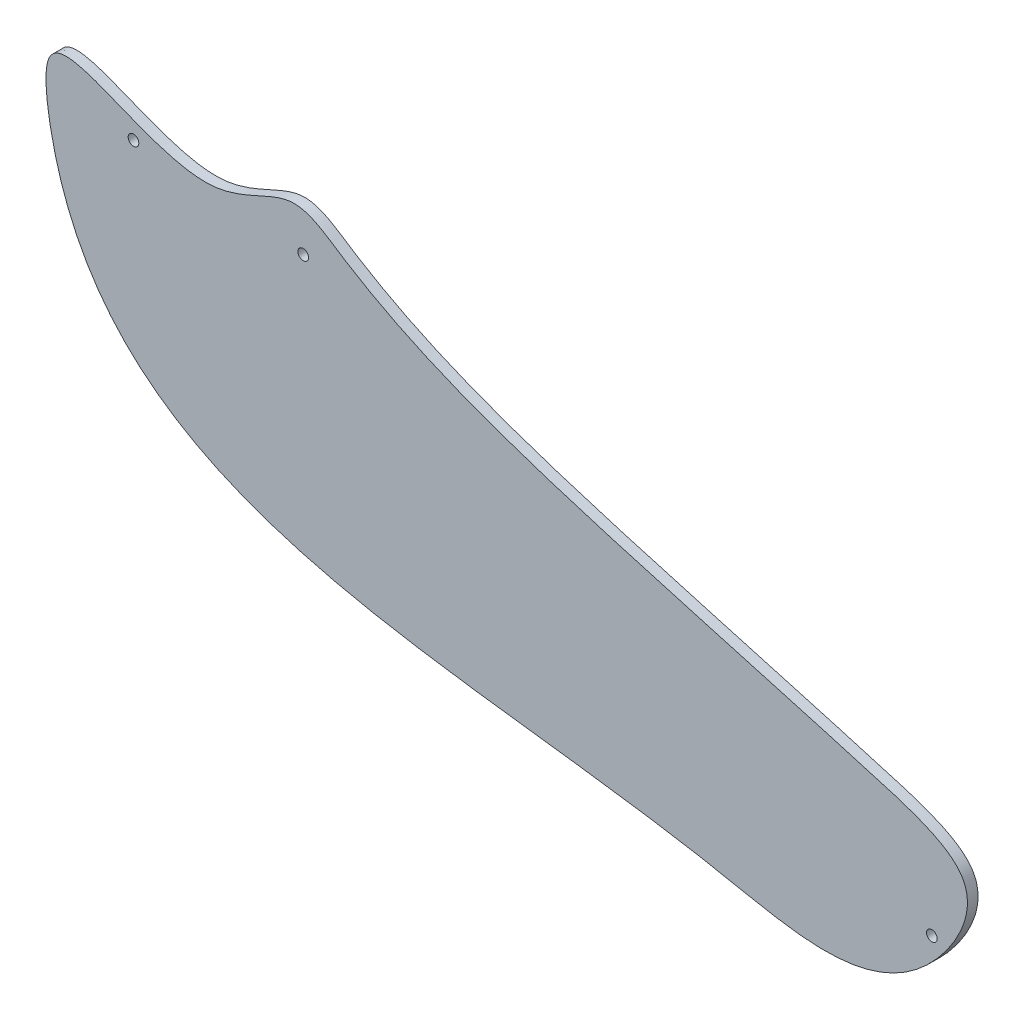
SolidWorks part; units mm, degrees
ref_plane "Front Plane" through (0, 0, 0) normal (0, 0, 1) x (1, 0, 0)
ref_plane "Top Plane" through (0, 0, 0) normal (0, 1, 0) x (1, 0, 0)
ref_plane "Right Plane" through (0, 0, 0) normal (1, 0, 0) x (0, 0, -1)
sketch "Sketch1" plane through (0, 0, 0) normal (0, 0, 1) x (1, 0, 0)
  line L0 (0, 0) -> (167.3801, -59.9727) construction
  circle A0 centre (210.5419, -68.9714) radius 1.5875
  circle A1 centre (22.8334, 13.3021) radius 1.5875
  circle A2 centre (-27.8499, 17.5584) radius 1.5875
  spline S0 degree 3 poles (63.0522, -2.599) (18.9657, 29.4048) (-10.8316, 5.9441) (-56.9542, 43.8579) (-44.197, -77.632) (75.0878, -66.7366) (180.4981, -91.7161) (209.4764, -83.2544) (229.5949, -47.0323) (119.9223, -14.5208) (63.0522, -2.599) (18.9657, 29.4048) (-10.8316, 5.9441) knots -0.336754 -0.29879 -0.033199 0 0.038972 0.12114 0.151272 0.516778 0.563687 0.620363 0.663246 0.70121 0.966801 1 1.038972 1.12114 1.151272 only from (18.7641, 25.0894) to (18.7641, 25.0894)
  dimension "D2" = 3.175
  dimension "D1" = 177.8
extrude "Boss-Extrude1" add sketch "Sketch1" along normal blind 3.175
